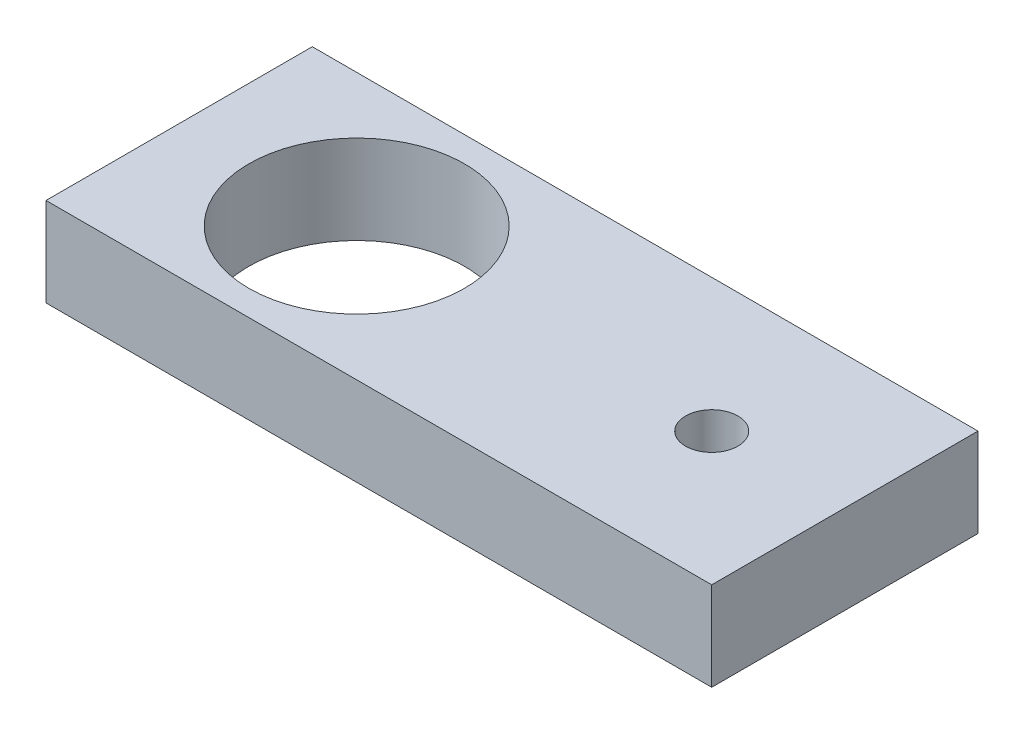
SolidWorks part; units mm, degrees
ref_plane "Front Plane" through (0, 0, 0) normal (0, 0, 1) x (1, 0, 0)
ref_plane "Top Plane" through (0, 0, 0) normal (0, 1, 0) x (1, 0, 0)
ref_plane "Right Plane" through (0, 0, 0) normal (1, 0, 0) x (0, 0, -1)
sketch "Sketch2" plane through (0, 0, 0) normal (0, 1, 0) x (1, 0, 0)
  line L1 (0, 0) -> (15, 0)
  line L2 (0, 0) -> (0, -6)
  line L3 (0, -6) -> (15, -6)
  line L4 (15, 0) -> (15, -6)
  dimension "D1" = 15
  dimension "D2" = 6
extrude "Boss-Extrude1" add sketch "Sketch2" along normal blind 2
sketch "Sketch3" plane through (0, 2, 0) normal (0, 1, 0) x (1, 0, 0)
  line L1 (15, -6) -> (15, 0) construction
  circle A0 centre (4, -3) radius 2.43
  circle A1 centre (12, -2.9998) radius 0.5901
  point P4 (3.2866, -3)
  point P5 (21.38, -3)
  point P6 (0, 0)
  point P7 (0, 0)
  point P11 (0.95, -3)
  dimension "D2" = 4.86
  dimension "D1" = 8
  dimension "D3" = 3
extrude "Cut-Extrude2" cut sketch "Sketch3" against normal through all
